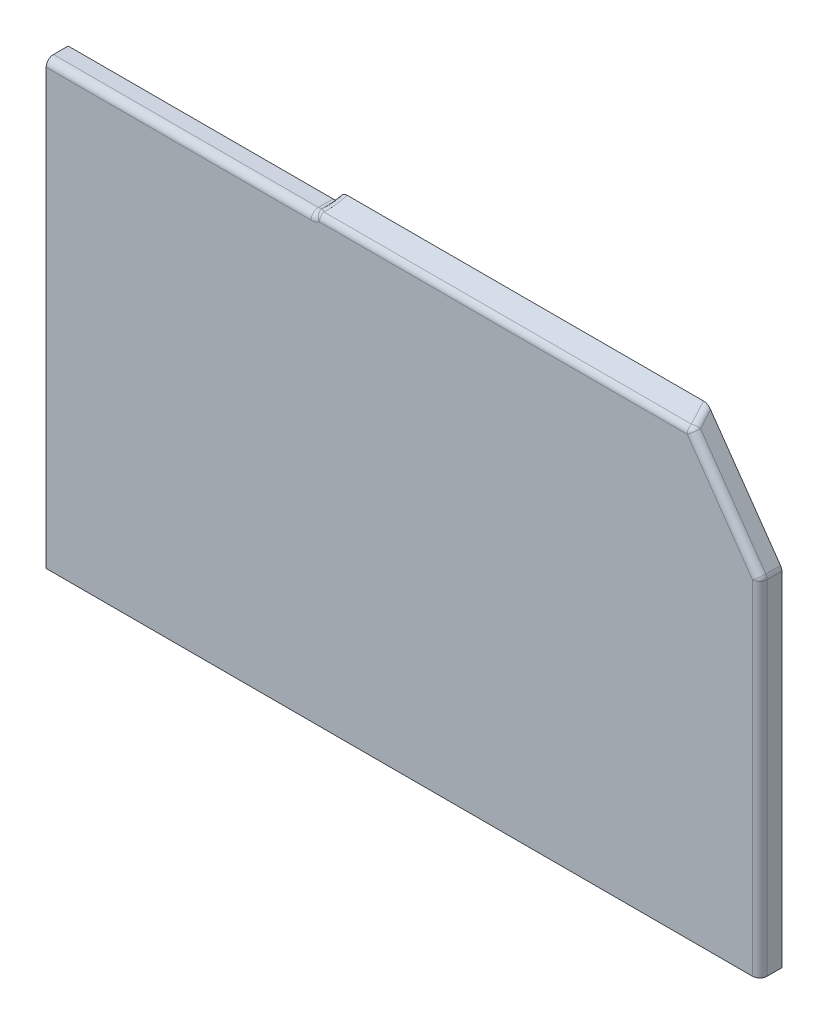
SolidWorks part; units mm, degrees
ref_plane "Ebene vorne" through (0, 0, 0) normal (0, 0, 1) x (1, 0, 0)
ref_plane "Ebene oben" through (0, 0, 0) normal (0, 1, 0) x (1, 0, 0)
ref_plane "Ebene rechts" through (0, 0, 0) normal (1, 0, 0) x (0, 0, -1)
sketch "Skizze1" plane through (0, 0, 0) normal (0, 0, 1) x (1, 0, 0)
  line L0 (0, 0) -> (97, 0)
  line L1 (0, 0) -> (0, 60)
  line L2 (0, 60) -> (37, 60)
  line L3 (37, 60) -> (37, 61.39)
  line L4 (37, 61.39) -> (86.93, 61.39)
  line L5 (86.93, 61.39) -> (97, 47)
  line L6 (97, 47) -> (97, 0)
  dimension "D1" = 97
  dimension "D2" = 60
  dimension "D3" = 37
  dimension "D4" = 1.39
  dimension "D5" = 49.93
  dimension "D6" = 47
extrude "Aufsatz-Linear austragen1" add sketch "Skizze1" along normal blind 3
sketch "Skizze2" plane through (0, 0, 0) normal (0, 0, -1) x (-1, 0, 0)
  line L0 (-97, 0) -> (-97, 47) construction
  line L1 (0, 0) -> (-97, 0) construction
  line L3 (0, 60) -> (0, 0) construction
  line L4 (-37, 60) -> (0, 60) construction
  circle A0 centre (-86, 51.5) radius 5
  circle A1 centre (-11, 52) radius 5
  circle A2 centre (-11, 8) radius 5
  circle A3 centre (-86, 8) radius 5
  dimension "D1" = 10
  dimension "D2" = 10
  dimension "D3" = 10
  dimension "D4" = 10
  dimension "D5" = 11
  dimension "D6" = 8
  dimension "D7" = 11
  dimension "D8" = 43.5
  dimension "D9" = 11
  dimension "D10" = 8
  dimension "D11" = 11
  dimension "D12" = 8
extrude "Schnitt-Linear austragen1" cut sketch "Skizze2" against normal blind 2.2
sketch "Skizze3" plane through (37, 0, 0) normal (-1, 0, 0) x (0, 0, 1)
  line L0 (3, 60) -> (0, 61.39)
  line L1 (0, 61.39) -> (3, 61.39)
  line L2 (3, 61.39) -> (3, 60)
extrude "Schnitt-Linear austragen2" cut sketch "Skizze3" against normal blind 78.1
fillet "Verrundung4" radius 1 1 edges at (37, 60, 1.5)
fillet "Verrundung6" radius 1 1 edges at (37, 61.195, 0.4209)
fillet "Verrundung7" radius 1 2 edges at (97, 47, 1.5) (87.4164, 60.695, 1.5)
fillet "Verrundung8" radius 1 7 edges at (97, 23.3424, 3) (96.9538, 46.9854, 3) (92.546, 53.3647, 3) (87.8451, 59.8588, 3) (61.9594, 60, 3) (35.7379, 59.9852, 3) (17.6991, 60, 3)
